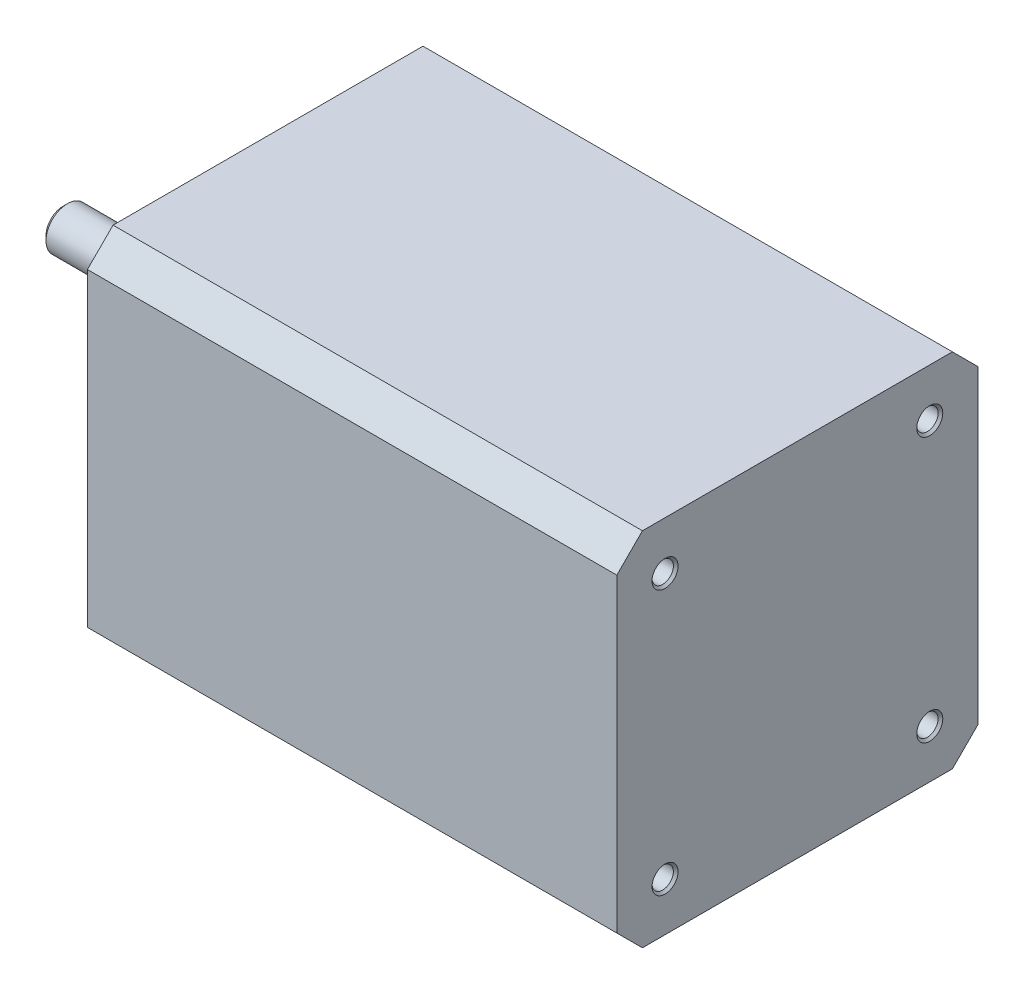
SolidWorks part; units mm, degrees
ref_plane "前视基准面" through (0, 0, 0) normal (0, 0, 1) x (1, 0, 0)
ref_plane "上视基准面" through (0, 0, 0) normal (0, 1, 0) x (1, 0, 0)
ref_plane "右视基准面" through (0, 0, 0) normal (1, 0, 0) x (0, 0, -1)
other "Configuration Table"
sketch "草图1" plane through (0, 0, 0) normal (1, 0, 0) x (0, 0, -1)
  line L0 (-21.15, 18.15) -> (-18.15, 21.15)
  line L1 (-18.15, 21.15) -> (18.15, 21.15)
  line L2 (-21.15, 18.15) -> (-21.15, -18.15)
  line L3 (-18.15, -21.15) -> (18.15, -21.15)
  line L4 (21.15, 18.15) -> (21.15, -18.15)
  line L5 (-21.15, 21.15) -> (21.15, -21.15) construction
  line L6 (-21.15, -21.15) -> (21.15, 21.15) construction
  line L7 (-21.15, -18.15) -> (-18.15, -21.15)
  line L8 (18.15, -21.15) -> (21.15, -18.15)
  line L9 (18.15, 21.15) -> (21.15, 18.15)
  point P0 (0, 0)
  dimension "D1" = 42.3
  dimension "D2" = 42.3
extrude "凸台-拉伸1" add sketch "草图1" along normal blind 62
sketch "草图2" plane through (0, 0, 0) normal (-1, 0, 0) x (0, 0, 1)
  circle A0 centre (0, 0) radius 11
  dimension "D1" = 22
extrude "凸台-拉伸2" add sketch "草图2" along normal blind 2
sketch "草图3" plane through (-2, 0, 0) normal (-1, 0, 0) x (0, 0, 1)
  circle A0 centre (0, 0) radius 2.5
  dimension "D1" = 5
extrude "凸台-拉伸3" add sketch "草图3" along normal blind 22
chamfer "倒角1" distance 0.5 angle 45 1 edges at (-24, 0, 2.5)
sketch "草图4" plane through (62, 0, 0) normal (1, 0, 0) x (0, 0, -1)
  line L0 (0, 27.4396) -> (0, -29.6756) construction
  line L1 (-28.4947, 0) -> (34.5977, 0) construction
  point P5 (-15.5, 15.5)
  point P6 (-15.5, -15.5)
  point P7 (15.5, -15.5)
  point P8 (15.5, 15.5)
  point P11 (-14.9908, 15.4853)
  point P12 (-11.7808, 9.8955)
  dimension "D1" = 31
  dimension "D2" = 31
hole_wizard "M3 螺纹孔1" positions "草图4" profile "草图5" tap size "M3" standard "GB"
sketch "草图5" plane through (62, 15.5, -15.5) normal (0, 1, 0) x (0, 0, -1)
  line L0 (0, 0) -> (0, 86)
  line L1 (0, 86) -> (1.25, 86)
  line L2 (1.25, 86) -> (1.25, 0.275)
  line L3 (1.25, 0.275) -> (1.525, 0)
  line L5 (1.525, 0) -> (0, 0)
  line L6 (-1.25, 0.275) -> (-1.525, 0) construction
  line L11 (0, -6.35) -> (0, 107.95) construction
  dimension "通孔螺纹孔钻头直径" = 2.5
  dimension "通孔螺纹孔钻头深度" = 86
  dimension "近端锥形沉头孔直径" = 3.05
  dimension "近端锥形沉头孔角度" = 90
